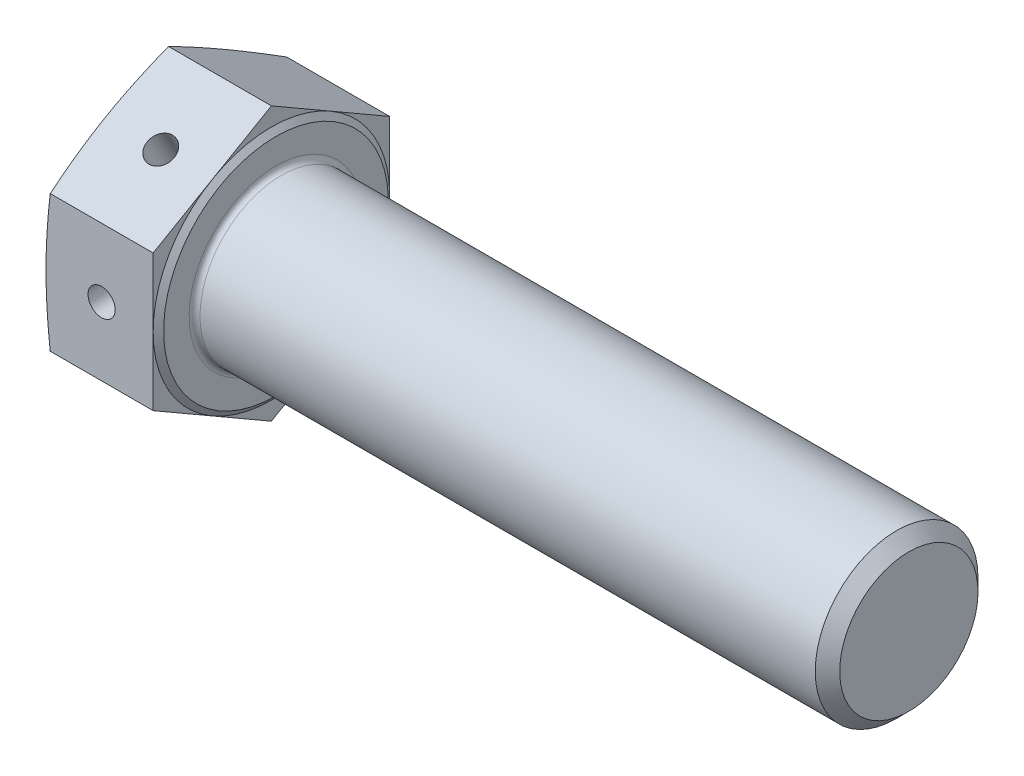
SolidWorks part; units mm, degrees
ref_plane "Front" through (0, 0, 0) normal (0, 0, 1) x (1, 0, 0)
ref_plane "Top" through (0, 0, 0) normal (0, 1, 0) x (1, 0, 0)
ref_plane "Right" through (0, 0, 0) normal (1, 0, 0) x (0, 0, -1)
sketch "Sketch-BaseHead" plane through (0, 0, 0) normal (1, 0, 0) x (0, 0, -1)
  line L1 (0, -15.1035) -> (13.08, -7.5517)
  line L2 (13.08, -7.5517) -> (13.08, 7.5517)
  line L3 (13.08, 7.5517) -> (0, 15.1035)
  line L4 (0, 15.1035) -> (-13.08, 7.5517)
  line L5 (-13.08, 7.5517) -> (-13.08, -7.5517)
  line L6 (-13.08, -7.5517) -> (0, -15.1035)
  circle A0 centre (0, 0) radius 13.08 construction
  dimension "s" = 26.16
extrude "BaseHead" add sketch "Sketch-BaseHead" along normal blind 11.85
sketch "Sketch4" plane through (-0.2646, -5.9169, 0) normal (0, 0, 1) x (0, 1, 0)
  line L0 (5.9169, 3.7369) -> (5.9169, -10.4477) construction
  line L2 (21.0204, -0.2646) -> (18.9969, -0.2646)
  line L4 (18.9969, -0.2646) -> (21.0204, -0.7348)
  line L6 (21.0204, -0.7348) -> (21.0204, -0.2646)
  dimension "D1" = 13.08
  dimension "D2" = 26.16
revolve "HeadChamfer" cut sketch "Sketch4" angle 360 about L0
sketch "Sketch2" plane through (0, 0, 0) normal (0, 1, 0) x (1, 0, 0)
  line L0 (11.85, 0) -> (12.35, 0)
  line L1 (12.35, 0) -> (12.35, 12.425)
  line L2 (12.35, 12.425) -> (11.85, 13.08)
  line L3 (11.85, 13.08) -> (11.85, 0)
  line L4 (11.85, 13.08) -> (11.85, 0) construction
  dimension "D1" = 13.08
  dimension "D2" = 12.425
  dimension "c" = 0.5
revolve "Revolve1" add sketch "Sketch2" angle 360 about axis through (-4.0016, 0, 0) along (1, 0, 0)
ref_plane "Plane2" through (40.35, 0, 0) normal (1, 0, 0) x (0, 0, -1)
sketch "Sketch3" plane through (12.35, 0, 0) normal (1, 0, 0) x (0, 0, -1)
  circle A0 centre (0, 0) radius 9
  dimension "d" = 18
extrude "BaseBody" add sketch "Sketch3" along normal blind 70
chamfer "Chamfer1" distance 1.353 angle 45 1 edges at (82.35, 9, 0)
fillet "HeadFillet" radius 0.6 1 edges at (12.35, -9, 0)
sketch "Sketch5" plane through (0, 0, 0) normal (0, 0, 1) x (1, 0, 0)
  line L1 (11.85, -11.3276) -> (11.85, -15.1035) construction
  line L2 (-4.0016, 0) -> (10.1831, 0) construction
  circle A0 centre (6.15, 0) radius 1.5
  dimension "d1" = 3
  dimension "h" = 5.7
extrude "Hole" cut sketch "Sketch5" against normal through all and the other way through all
pattern_circular "CirPattern1" count 2 over 60 about axis through (82.35, 0, 0) along (-1, 0, 0) of "Hole"
equation "\"D1@Sketch4\" = \"s@Sketch-BaseHead\"/ 2 "
equation "\"D2@Sketch4\" = \"s@Sketch-BaseHead\""
equation "\"D1@Chamfer1\" =  ( \"d@Sketch3\" - \"D2@ThreadCosmetic1\" ) / 2 "
equation "\"b@ThreadCosmetic1\" = \"l@BaseBody\" - \"lg@Plane2\""
equation "\"D1@Sketch2\"=\"s@Sketch-BaseHead\"/2"
